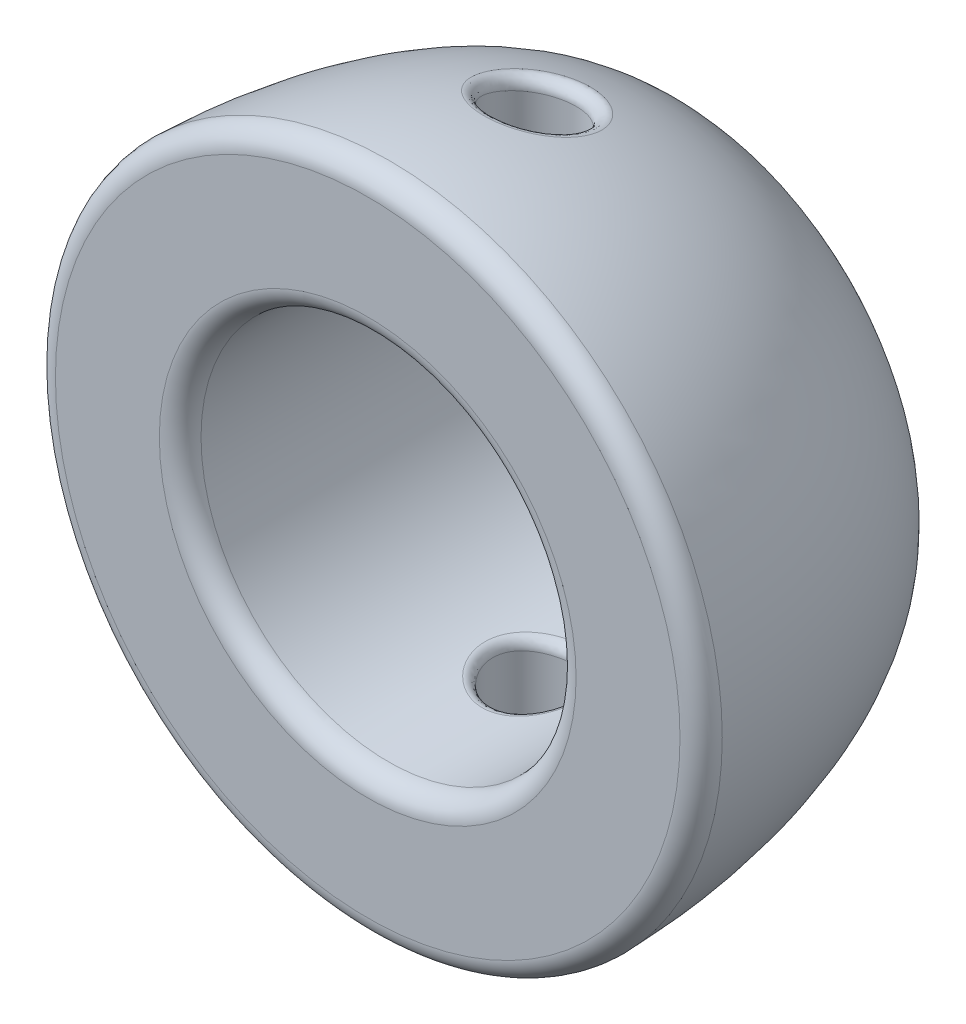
SolidWorks part; units mm, degrees
ref_plane "Спереди" through (0, 0, 0) normal (0, 0, 1) x (1, 0, 0)
ref_plane "Сверху" through (0, 0, 0) normal (0, 1, 0) x (1, 0, 0)
ref_plane "Справа" through (0, 0, 0) normal (1, 0, 0) x (0, 0, -1)
sketch "Эскиз1" plane through (0, 0, 0) normal (1, 0, 0) x (0, 0, -1)
  line L0 (-4, 0) -> (4, 0) construction
  line L1 (-4, 4.5) -> (4, 4.5)
  line L2 (-4, 4.5) -> (-4, 8)
  ellipse E0 centre (-4, 4.5) end of major axis (4, 4.5) minor radius 3.5 (4, 4.5) -> (-4, 8) ccw
  dimension "D1" = 8
  dimension "D2" = 9
  dimension "D3" = 16
revolve "Повернуть1" add sketch "Эскиз1" angle 360 about L0
fillet "Скругление1" radius 0.5 3 edges at (8, 0, 4) (4.5, 0, 4) (4.5, 0, -4)
sketch "Эскиз2" plane through (0, 0, 0) normal (0, 1, 0) x (1, 0, 0)
  circle A0 centre (0, 0) radius 1
  dimension "D1" = 2
extrude "Вырез-Вытянуть1" cut sketch "Эскиз2" against normal mid plane 20
fillet "Скругление2" radius 0.25 4 edges at (0.2027, -4.4954, -0.9792) (-0.2027, 4.4954, -0.9792) (0.2239, 7.2376, -0.9746) (-0.2239, -7.2376, -0.9746)
